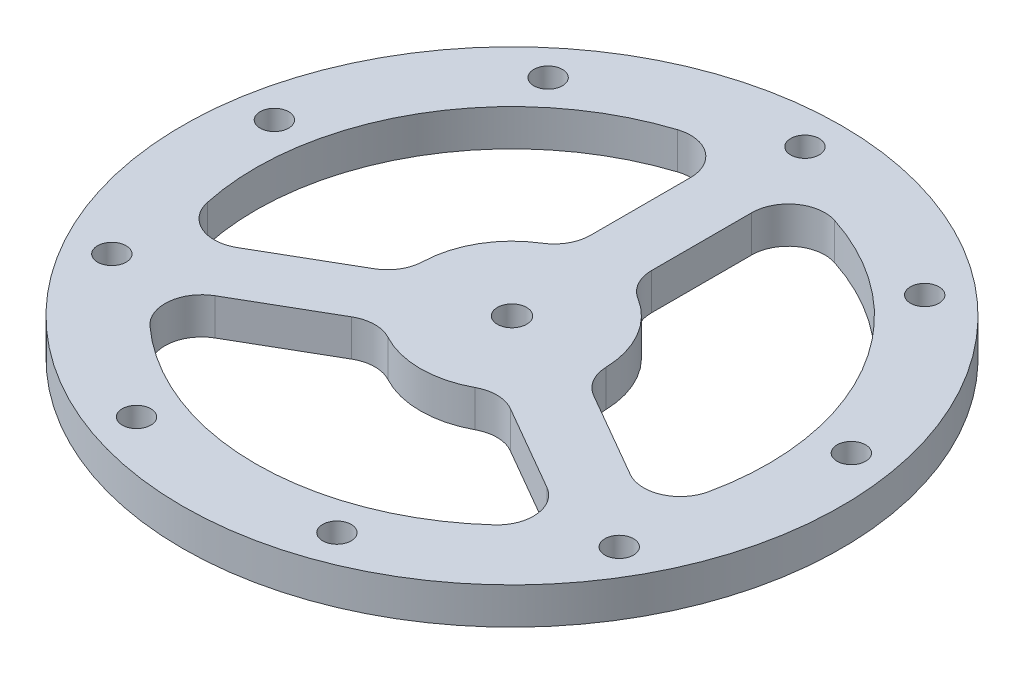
SolidWorks part; units mm, degrees
other "Camera1"
ref_plane "Front Plane" through (0, 0, 0) normal (0, 0, 1) x (1, 0, 0)
ref_plane "Top Plane" through (0, 0, 0) normal (0, 1, 0) x (1, 0, 0)
ref_plane "Right Plane" through (0, 0, 0) normal (1, 0, 0) x (0, 0, -1)
sketch "Sketch1" plane through (0, 0, 0) normal (0, 1, 0) x (1, 0, 0)
  circle A0 centre (0, 0) radius 45
  dimension "D1" = 90
extrude "Boss-Extrude1" add sketch "Sketch1" along normal blind 5 contours A0
sketch "Sketch2" plane through (0, 5, 0) normal (0, 1, 0) x (1, 0, 0)
  circle A0 centre (0, 0) radius 2
  dimension "D1" = 4
extrude "Cut-Extrude1" cut sketch "Sketch2" against normal through all both and the other way through all
sketch "Sketch4" plane through (0, 5, 0) normal (0, 1, 0) x (1, 0, 0)
  line L0 (-4.1667, 11.7851) -> (-4.1667, 34.7511)
  line L1 (4.1667, 11.7851) -> (4.1667, 34.7511)
  line L2 (12.2895, -2.2841) -> (32.1787, -13.7671)
  line L3 (8.1229, -9.501) -> (28.012, -20.984)
  line L4 (-8.1229, -9.501) -> (-28.012, -20.984)
  line L5 (-12.2895, -2.2841) -> (-32.1787, -13.7671)
  line L6 (-45, 0) -> (-35, 0)
  circle A0 centre (0, 0) radius 35
  circle A1 centre (0, 0) radius 12.5
  circle A4 centre (0, 0) radius 45 construction
  point P23 (0, 0)
  dimension "D1" = 3
  dimension "D2" = 25
  dimension "D3" = 10
extrude "Cut-Extrude2" cut sketch "Sketch4" along normal through all and the other way through all contours A1 L2 A0 L1 | A1 L0 A0 L5 | A1 L4 A0 L3
ref_plane "Plane1" through (0, 2.5, 0) normal (0, 1, 0) x (1, 0, 0)
fillet "Fillet1" radius 5 6 edges at (32.1787, 2.5, 13.7671) (28.012, 2.5, 20.984) (-28.012, 2.5, 20.984) (-32.1787, 2.5, 13.7671) (-4.1667, 2.5, -34.7511) (4.1667, 2.5, -34.7511)
fillet "Fillet2" radius 5 6 edges at (-12.2895, 2.5, 2.2841) (-8.1229, 2.5, 9.501) (8.1229, 2.5, 9.501) (12.2895, 2.5, 2.2841) (4.1667, 2.5, -11.7851) (-4.1667, 2.5, -11.7851)
sketch "Sketch5" plane through (0, 5, 0) normal (0, 1, 0) x (1, 0, 0)
  line L0 (0, 35) -> (0, 45) construction
  circle A0 centre (0, 0) radius 35 construction
  circle A1 centre (0, 0) radius 45 construction
  circle A2 centre (0, 40) radius 1.95
  dimension "D1" = 3.9
extrude "Cut-Extrude3" cut sketch "Sketch5" against normal through all contours A2
pattern_circular "CirPattern1" count 9 over 360 about axis through (0, 0, 0) along (0, 1, 0) of "Cut-Extrude3"
